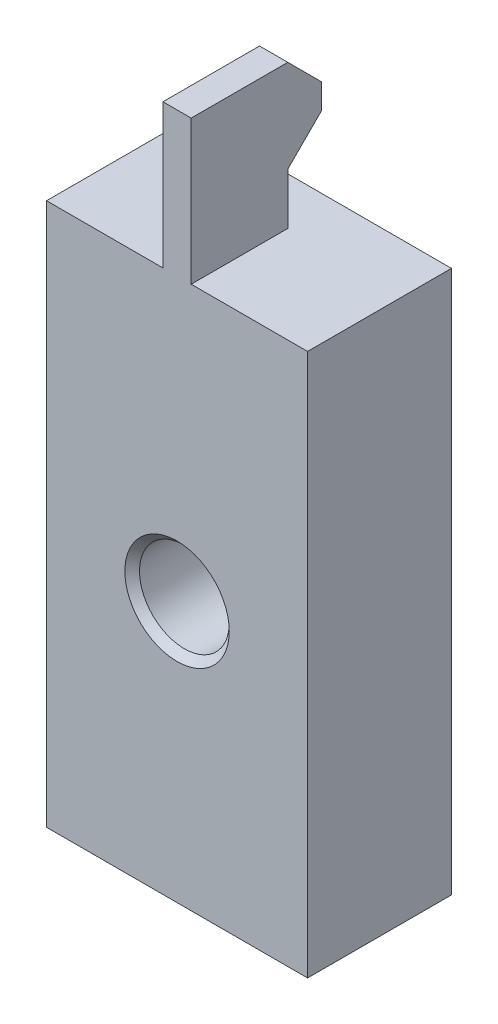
SolidWorks part; units mm, degrees
ref_plane "Front" through (0, 0, 0) normal (0, 0, 1) x (1, 0, 0)
ref_plane "Top" through (0, 0, 0) normal (0, 1, 0) x (1, 0, 0)
ref_plane "Right" through (0, 0, 0) normal (1, 0, 0) x (0, 0, -1)
sketch "Sketch1" plane through (0, 0, 0) normal (0, 0, 1) x (1, 0, 0)
  line L1 (-6.35, 26.4) -> (6.35, 26.4)
  line L2 (-6.35, 26.4) -> (-6.35, 0)
  line L3 (-6.35, 0) -> (6.35, 0)
  line L4 (6.35, 26.4) -> (6.35, 0)
  dimension "D1" = 12.7
  dimension "D2" = 26.4
extrude "Extrude1" add sketch "Sketch1" along normal blind 7
hole_wizard " (0.17188) Diameter Hole1" positions "3DSketch1" profile "Sketch3" hole size "11/64" standard "Ansi Inch"
sketch3d "3DSketch1"
  line L0 (0, 0, 7) -> (0, 12.7, 7) construction
  line L1 (-6.35, 0, 7) -> (6.35, 0, 7) construction
  point P0 (0, 12.7, 7)
  dimension "D1" = 12.7
sketch "Sketch3" plane through (0, 12.7, 7) normal (1, 0, 0) x (0, -1, 0)
  line L0 (0, 0) -> (0, 7)
  line L1 (0, 7) -> (2.1829, 7)
  line L2 (2.1829, 7) -> (2.1829, 0.3571)
  line L3 (2.1829, 0.3571) -> (2.54, 0)
  line L5 (2.54, 0) -> (0, 0)
  line L6 (-2.1829, 0.3571) -> (-2.54, 0) construction
  line L11 (0, -6.35) -> (0, 107.95) construction
  dimension "Thru Hole Dia." = 4.3658
  dimension "Thru Hole Depth" = 7
  dimension "Near C'Sink Dia." = 5.08
  dimension "Near C'Sink Angle" = 90
sketch "Sketch4" plane through (-6.35, 0, 0) normal (-1, 0, 0) x (0, 0, 1)
  line L1 (7, 26.4) -> (0.65, 26.4)
  line L2 (7, 26.4) -> (7, 33.4)
  line L3 (7, 33.4) -> (0.65, 33.4)
  line L4 (0.65, 26.4) -> (0.65, 33.4)
  dimension "D1" = 7
  dimension "D2" = 6.35
extrude "Extrude2" add sketch "Sketch4" against normal up to surface (12.7 mm away)
sketch "Sketch5" plane through (-6.35, 0, 0) normal (-1, 0, 0) x (0, 0, 1)
  line L1 (0.65, 26.4) -> (2.3, 26.4)
  line L2 (0.65, 26.4) -> (0.65, 28.9)
  line L3 (0.65, 28.9) -> (2.3, 28.9)
  line L4 (2.3, 26.4) -> (2.3, 28.9)
  dimension "D1" = 2.5
  dimension "D2" = 1.65
extrude "Extrude3" cut sketch "Sketch5" against normal up to next
chamfer "Chamfer1" distance 1.65 angle 45 2 edges at (0, 28.9, 0.65) (0, 33.4, 0.65)
sketch "Sketch6" plane through (0, 0, 0) normal (0, 0, -1) x (-1, 0, 0)
  line L0 (-6.35, 33.4) -> (6.35, 33.4) construction
  line L1 (-6.35, 26.4) -> (-0.6875, 26.4)
  line L2 (-6.35, 26.4) -> (-6.35, 33.4)
  line L3 (-6.35, 33.4) -> (-0.6875, 33.4)
  line L4 (-0.6875, 26.4) -> (-0.6875, 33.4)
  line L6 (6.35, 26.4) -> (5.45, 26.4)
  line L7 (6.35, 26.4) -> (6.35, 33.4)
  line L8 (6.35, 33.4) -> (5.45, 33.4)
  line L9 (5.45, 26.4) -> (5.45, 33.4)
  dimension "D1" = 5.6625
  dimension "D2" = 0.9
extrude "Extrude4" cut sketch "Sketch6" against normal through all
sketch "Sketch7" plane through (0, 0, 0) normal (0, 0, -1) x (-1, 0, 0)
  line L0 (-0.6875, 33.4) -> (5.45, 33.4) construction
  line L1 (-6.35, 26.4) -> (-5.45, 26.4)
  line L2 (-6.35, 26.4) -> (-6.35, 33.4)
  line L3 (-6.35, 33.4) -> (-5.45, 33.4)
  line L4 (-5.45, 26.4) -> (-5.45, 33.4)
  line L5 (6.35, 26.4) -> (0.6875, 26.4)
  line L6 (6.35, 26.4) -> (6.35, 33.4)
  line L7 (6.35, 33.4) -> (0.6875, 33.4)
  line L8 (0.6875, 26.4) -> (0.6875, 33.4)
  dimension "D1" = 0.9
  dimension "D2" = 5.6625
extrude "Extrude5" cut sketch "Sketch7" against normal through all
